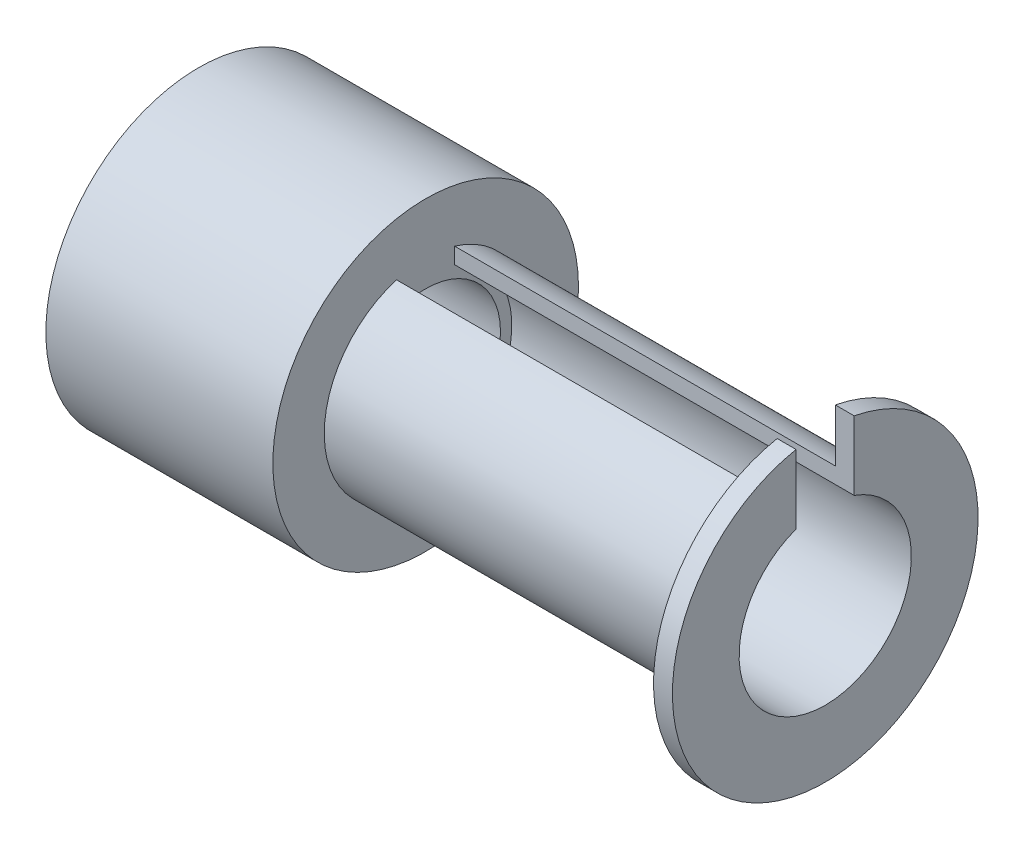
SolidWorks part; units mm, degrees
ref_plane "Front Plane" through (0, 0, 0) normal (0, 0, 1) x (1, 0, 0)
ref_plane "Top Plane" through (0, 0, 0) normal (0, 1, 0) x (1, 0, 0)
ref_plane "Right Plane" through (0, 0, 0) normal (1, 0, 0) x (0, 0, -1)
sketch "Sketch6" plane through (0, 0, 0) normal (1, 0, 0) x (0, 0, -1)
  line L0 (2.6465, 8.8852) -> (2.6465, 7.4159)
  line L1 (-2.6678, 7.4083) -> (-2.6678, 8.8789)
  circle A0 centre (0, 0) radius 7.874
  circle A1 centre (0, 0) radius 9.271
  dimension "D1" = 5.3143
  dimension "D2" = 18.542
  dimension "D3" = 15.748
  dimension "D4" = 2.6678
extrude "Boss-Extrude5" add sketch "Sketch6" along normal blind 36.5252 contours L1 A1 L0 A0
sketch "Sketch7" plane through (0, 0, 0) normal (1, 0, 0) x (0, 0, -1)
  line L1 (6.35, -2.54) -> (-6.35, -2.54)
  line L2 (6.35, -2.54) -> (6.35, 2.54)
  line L3 (6.35, 2.54) -> (-6.35, 2.54)
  line L4 (-6.35, -2.54) -> (-6.35, 2.54)
  line L5 (6.35, -2.54) -> (-6.35, 2.54) construction
  line L6 (6.35, 2.54) -> (-6.35, -2.54) construction
  circle A0 centre (0, 0) radius 9.271
  circle A1 centre (0, 0) radius 13.97
  circle A2 centre (0, 0) radius 6.8392
  dimension "D3" = 27.94
  dimension "D1" = 12.7
  dimension "D2" = 5.08
extrude "Boss-Extrude6" add sketch "Sketch7" against normal blind 19.05 contours A1 A0 | A0 L1 L4 L3 L2
sketch "Sketch8" plane through (36.5252, 0, 0) normal (1, 0, 0) x (0, 0, -1)
  line L0 (-2.6678, 7.4083) -> (-2.6678, 13.7129)
  line L2 (2.6465, 7.4159) -> (2.6465, 13.717)
  arc A0 (-2.6678, 8.2468) -> (2.6465, 8.2536) centre (0, 0) ccw
  circle A1 centre (0, 0) radius 13.97
  arc A2 (-2.6678, 7.4083) -> (2.6465, 7.4159) centre (0, 0) ccw construction
  dimension "D1" = 27.94
extrude "Boss-Extrude7" add sketch "Sketch8" against normal blind 1.7272 contours L0 A1 L2 M2 | M4 M1 M2 M3 | A0 L2 M1 M4
sketch "Sketch9" plane through (-19.05, 0, 0) normal (-1, 0, 0) x (0, 0, 1)
  circle A0 centre (0, 0) radius 13.97
extrude "Boss-Extrude8" add sketch "Sketch9" along normal blind 1.7018
